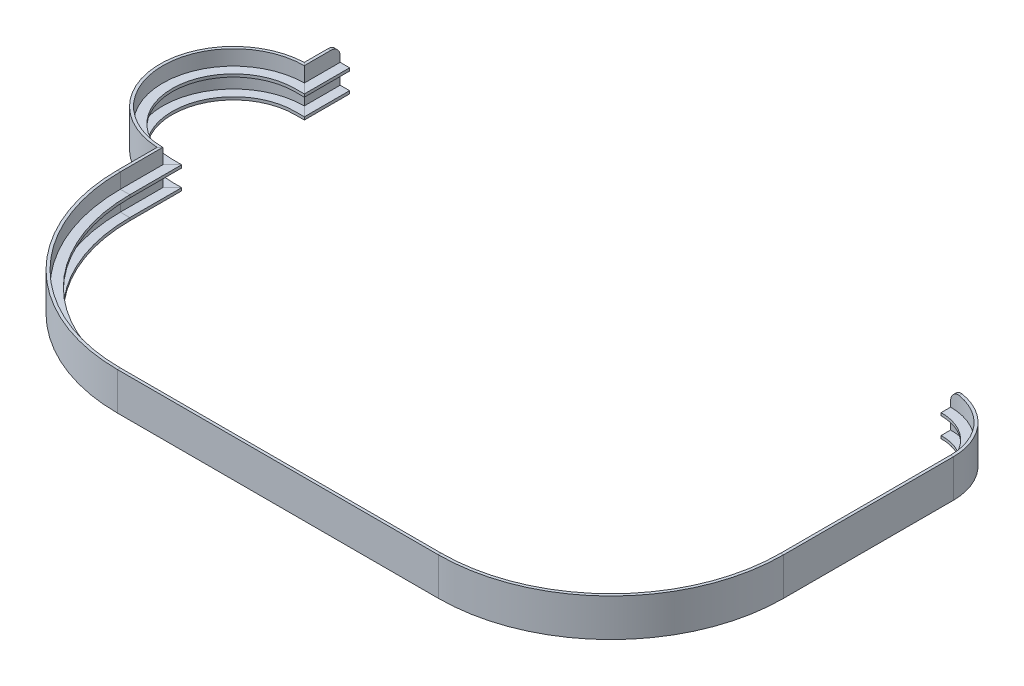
SolidWorks part; units mm, degrees
ref_plane "Front Plane" through (0, 0, 0) normal (0, 0, 1) x (1, 0, 0)
ref_plane "Top Plane" through (0, 0, 0) normal (0, 1, 0) x (1, 0, 0)
ref_plane "Right Plane" through (0, 0, 0) normal (1, 0, 0) x (0, 0, -1)
body saved out of another part "Stock-V1-1"
move or copy body "Body-Move/Copy1" bodies to move or copy 101 copy no rotation origin (18.75, 0, -45) rotation axis (0, 1, 0) rotation angle 180
